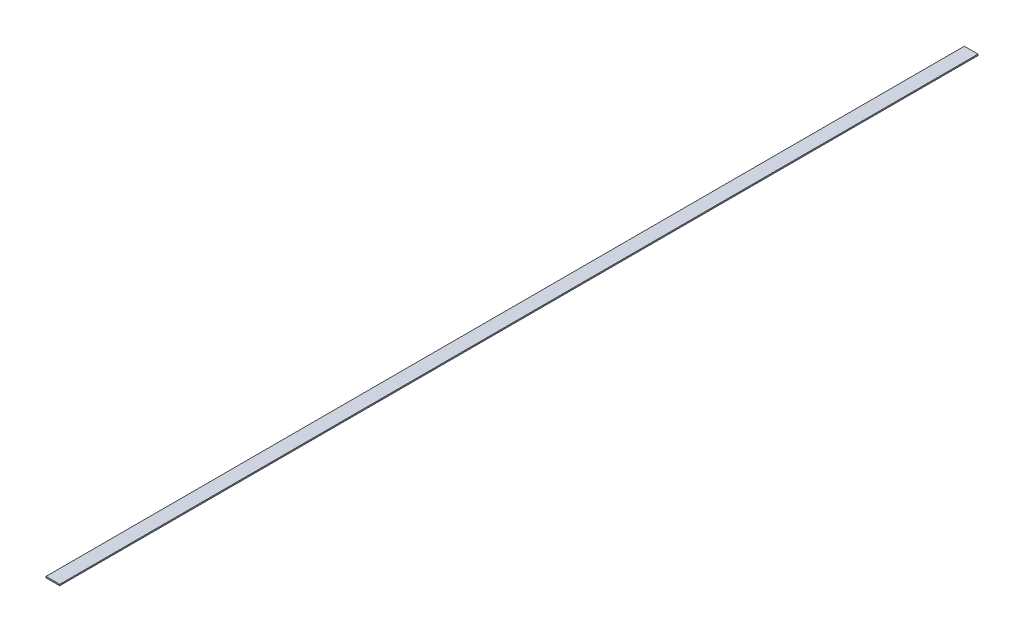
SolidWorks part; units mm, degrees
ref_plane "Front Plane" through (0, 0, 0) normal (0, 0, 1) x (1, 0, 0)
ref_plane "Top Plane" through (0, 0, 0) normal (0, 1, 0) x (1, 0, 0)
ref_plane "Right Plane" through (0, 0, 0) normal (1, 0, 0) x (0, 0, -1)
ref_plane "Plane1" through (0, 24.6466, 0) normal (0, -1, 0) x (1, 0, 0)
sketch "Sketch1" plane through (0, 24.6466, 0) normal (0, -1, 0) x (1, 0, 0)
  line L0 (-44.4152, 0) -> (6.3848, 0)
  line L1 (6.3848, 0) -> (6.3848, 3403.6)
  line L2 (6.3848, 3403.6) -> (-44.4152, 3403.6)
  line L3 (-44.4152, 3403.6) -> (-44.4152, 0)
extrude "Boss-Extrude1" add sketch "Sketch1" against normal blind 4.7625
